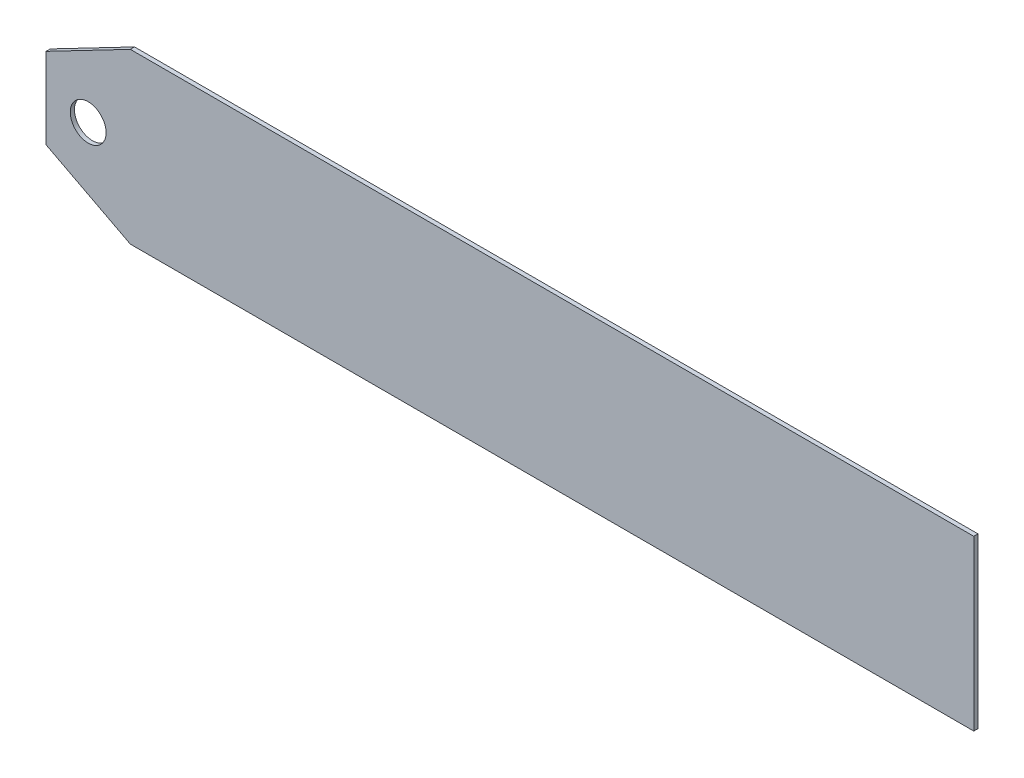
SolidWorks part; units mm, degrees
ref_plane "Спереди" through (0, 0, 0) normal (0, 0, 1) x (1, 0, 0)
ref_plane "Сверху" through (0, 0, 0) normal (0, 1, 0) x (1, 0, 0)
ref_plane "Справа" through (0, 0, 0) normal (1, 0, 0) x (0, 0, -1)
sketch "Эскиз1" plane through (0, 0, 0) normal (0, 0, 1) x (1, 0, 0)
  line L0 (-111.8097, 0) -> (207.3318, 0) construction
  line L1 (0, 39.9234) -> (0, -38.7173) construction
  line L2 (-20, 9.5887) -> (-20, -9.5887)
  line L3 (-20, -9.5887) -> (0, -20)
  line L4 (0, -20) -> (200, -20)
  line L5 (200, -20) -> (200, 20)
  line L7 (0, -39.9234) -> (0, 38.7173) construction
  line L8 (0, 20) -> (200, 20)
  line L9 (-20, 9.5887) -> (0, 20)
  circle A0 centre (-10, 0) radius 4.25
  dimension "D5" = 8.5
  dimension "D1" = 40
  dimension "D2" = 117.5
  dimension "D3" = 220
  dimension "D4" = 200
  dimension "D6" = 10
extrude "Вытянуть1" add sketch "Эскиз1" along normal blind 1
sketch "Эскиз2" plane through (0, 0, 0) normal (0, 0, 1) x (1, 0, 0)
  line L0 (-37.5791, 0) -> (241.8498, 0) construction
